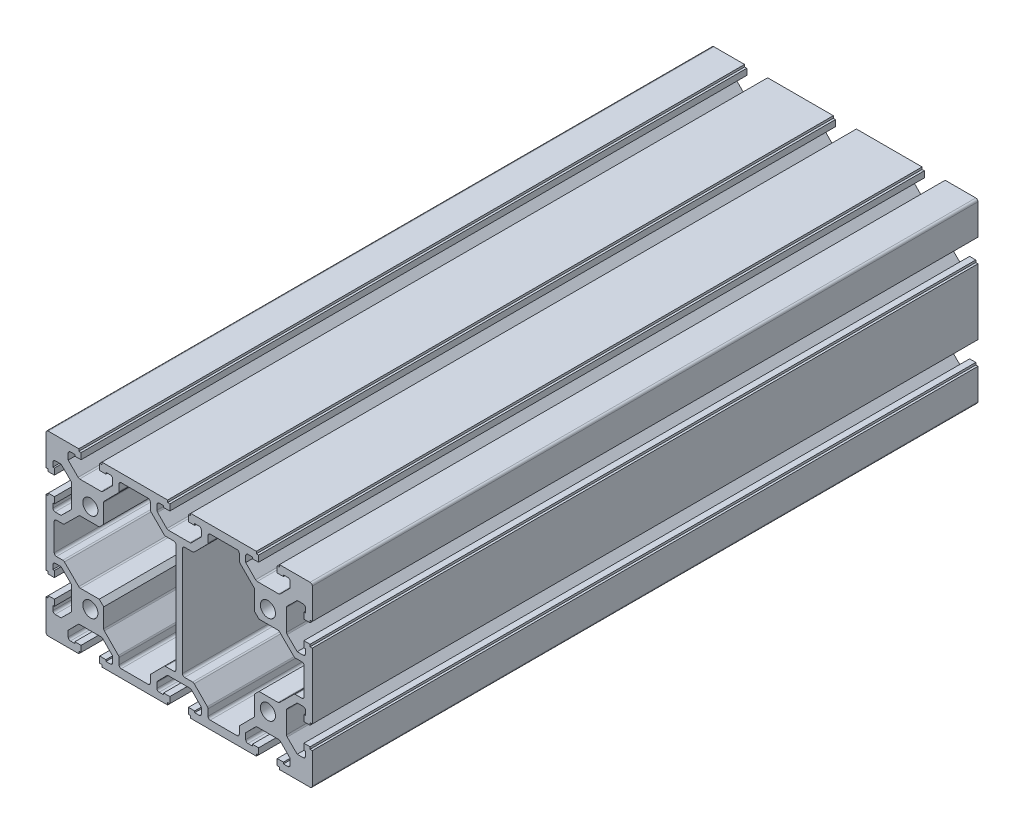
SolidWorks part; units mm, degrees
ref_plane "前视基准面" through (0, 0, 0) normal (0, 0, 1) x (1, 0, 0)
ref_plane "上视基准面" through (0, 0, 0) normal (0, 1, 0) x (1, 0, 0)
ref_plane "右视基准面" through (0, 0, 0) normal (1, 0, 0) x (0, 0, -1)
sketch "Model" plane through (0, 0, 0) normal (0, 0, 1) x (1, 0, 0)
  line L248 (1930.6182, 2016.6845) -> (1930.6182, 1992.2845)
  line L249 (1931.6182, 1991.2845) -> (1935.2528, 1991.2845)
  line L250 (1935.9636, 1990.9879) -> (1941.879, 1985.0102)
  line L251 (1942.1682, 1984.3068) -> (1942.1682, 1981.3845)
  line L252 (1943.1682, 1980.3845) -> (1955.2682, 1980.3845)
  line L253 (1956.2682, 1981.3845) -> (1956.2682, 1984.2657)
  line L254 (1956.5574, 1984.9691) -> (1962.879, 1991.3572)
  line L255 (1963.1682, 1992.0606) -> (1963.1682, 2000.5845)
  line L256 (1963.1682, 2000.5845) -> (1965.1682, 2002.5845)
  line L257 (1965.1682, 2002.5845) -> (1973.691, 2002.5845)
  line L258 (1974.3944, 2002.8737) -> (1980.8836, 2009.2953)
  line L259 (1981.587, 2009.5845) -> (1984.4682, 2009.5845)
  line L260 (1985.4682, 2010.5845) -> (1985.4682, 2016.6845)
  line L261 (1985.4682, 2016.6845) -> (1985.4682, 2022.7845)
  line L262 (1984.4682, 2023.7845) -> (1981.587, 2023.7845)
  line L263 (1980.8836, 2024.0737) -> (1974.3944, 2030.4953)
  line L264 (1973.691, 2030.7845) -> (1965.1682, 2030.7845)
  line L265 (1965.1682, 2030.7845) -> (1963.1682, 2032.7845)
  line L266 (1963.1682, 2032.7845) -> (1963.1682, 2041.3084)
  line L267 (1962.879, 2042.0118) -> (1956.5574, 2048.3999)
  line L268 (1956.2682, 2049.1033) -> (1956.2682, 2051.9845)
  line L269 (1955.2682, 2052.9845) -> (1943.1682, 2052.9845)
  line L270 (1942.1682, 2051.9845) -> (1942.1682, 2049.0622)
  line L271 (1941.879, 2048.3588) -> (1935.9636, 2042.3811)
  line L272 (1935.2528, 2042.0845) -> (1931.6182, 2042.0845)
  line L273 (1930.6182, 2041.0845) -> (1930.6182, 2016.6845)
  line L274 (1924.3355, 1988.2845) -> (1929.1682, 1988.2845)
  line L275 (1929.1682, 1988.2845) -> (1934.0009, 1988.2845)
  line L276 (1934.7117, 1987.9879) -> (1938.879, 1983.7768)
  line L277 (1939.1682, 1983.0734) -> (1939.1682, 1980.7845)
  line L278 (1938.1682, 1979.7845) -> (1936.1682, 1979.7845)
  line L279 (1936.1682, 1979.7845) -> (1936.1682, 1980.4845)
  line L280 (1936.1682, 1980.4845) -> (1933.3682, 1980.4845)
  line L281 (1933.3682, 1980.4845) -> (1933.3682, 1977.6845)
  line L282 (1933.3682, 1977.6845) -> (1934.3682, 1977.6845)
  line L283 (1934.3682, 1977.6845) -> (1934.3682, 1976.6845)
  line L284 (1934.3682, 1976.6845) -> (1963.9682, 1976.6845)
  line L285 (1963.9682, 1976.6845) -> (1963.9682, 1977.6845)
  line L286 (1963.9682, 1977.6845) -> (1964.9682, 1977.6845)
  line L287 (1964.9682, 1977.6845) -> (1964.9682, 1980.4845)
  line L288 (1964.9682, 1980.4845) -> (1962.1682, 1980.4845)
  line L289 (1962.1682, 1980.4845) -> (1962.1682, 1979.7845)
  line L290 (1962.1682, 1979.7845) -> (1960.1682, 1979.7845)
  line L291 (1959.1682, 1980.7845) -> (1959.1682, 1983.4845)
  line L292 (1959.1682, 1983.4845) -> (1963.6247, 1987.9879)
  line L293 (1964.3355, 1988.2845) -> (1969.1682, 1988.2845)
  line L294 (1969.1682, 1988.2845) -> (1974.0009, 1988.2845)
  line L295 (1974.7117, 1987.9879) -> (1979.1682, 1983.4845)
  line L296 (1979.1682, 1983.4845) -> (1979.1682, 1980.7845)
  line L297 (1978.1682, 1979.7845) -> (1976.1682, 1979.7845)
  line L298 (1976.1682, 1979.7845) -> (1976.1682, 1980.4845)
  line L299 (1976.1682, 1980.4845) -> (1973.3682, 1980.4845)
  line L300 (1973.3682, 1980.4845) -> (1973.3682, 1977.6845)
  line L301 (1973.3682, 1977.6845) -> (1974.3682, 1977.6845)
  line L302 (1974.3682, 1977.6845) -> (1974.3682, 1976.6845)
  line L303 (1974.3682, 1976.6845) -> (1988.1682, 1976.6845)
  line L304 (1989.1682, 1977.6845) -> (1989.1682, 1991.4845)
  line L305 (1989.1682, 1991.4845) -> (1988.1682, 1991.4845)
  line L306 (1988.1682, 1991.4845) -> (1988.1682, 1992.4845)
  line L307 (1988.1682, 1992.4845) -> (1985.3682, 1992.4845)
  line L308 (1985.3682, 1992.4845) -> (1985.3682, 1989.6845)
  line L309 (1985.3682, 1989.6845) -> (1986.0682, 1989.6845)
  line L310 (1986.0682, 1989.6845) -> (1986.0682, 1987.6845)
  line L311 (1985.0682, 1986.6845) -> (1982.3682, 1986.6845)
  line L312 (1982.3682, 1986.6845) -> (1977.8648, 1991.141)
  line L313 (1977.5682, 1991.8518) -> (1977.5682, 1996.6845)
  line L314 (1977.5682, 1996.6845) -> (1977.5682, 2001.5172)
  line L315 (1977.8648, 2002.228) -> (1982.3682, 2006.6845)
  line L316 (1982.3682, 2006.6845) -> (1985.0682, 2006.6845)
  line L317 (1986.0682, 2005.6845) -> (1986.0682, 2003.6845)
  line L318 (1986.0682, 2003.6845) -> (1985.3682, 2003.6845)
  line L319 (1985.3682, 2003.6845) -> (1985.3682, 2000.8845)
  line L320 (1985.3682, 2000.8845) -> (1988.1682, 2000.8845)
  line L321 (1988.1682, 2000.8845) -> (1988.1682, 2001.8845)
  line L322 (1988.1682, 2001.8845) -> (1989.1682, 2001.8845)
  line L323 (1989.1682, 2001.8845) -> (1989.1682, 2016.6845)
  line L324 (1989.1682, 2016.6845) -> (1989.1682, 2031.4845)
  line L325 (1989.1682, 2031.4845) -> (1988.1682, 2031.4845)
  line L326 (1988.1682, 2031.4845) -> (1988.1682, 2032.4845)
  line L327 (1988.1682, 2032.4845) -> (1985.3682, 2032.4845)
  line L328 (1985.3682, 2032.4845) -> (1985.3682, 2029.6845)
  line L329 (1985.3682, 2029.6845) -> (1986.0682, 2029.6845)
  line L330 (1986.0682, 2029.6845) -> (1986.0682, 2027.6845)
  line L331 (1985.0682, 2026.6845) -> (1982.3682, 2026.6845)
  line L332 (1982.3682, 2026.6845) -> (1977.8648, 2031.141)
  line L333 (1977.5682, 2031.8518) -> (1977.5682, 2036.6845)
  line L334 (1977.5682, 2036.6845) -> (1977.5682, 2041.5172)
  line L335 (1977.8648, 2042.228) -> (1982.3682, 2046.6845)
  line L336 (1982.3682, 2046.6845) -> (1985.0682, 2046.6845)
  line L337 (1986.0682, 2045.6845) -> (1986.0682, 2043.6845)
  line L338 (1986.0682, 2043.6845) -> (1985.3682, 2043.6845)
  line L339 (1985.3682, 2043.6845) -> (1985.3682, 2040.8845)
  line L340 (1985.3682, 2040.8845) -> (1988.1682, 2040.8845)
  line L341 (1988.1682, 2040.8845) -> (1988.1682, 2041.8845)
  line L342 (1988.1682, 2041.8845) -> (1989.1682, 2041.8845)
  line L343 (1989.1682, 2041.8845) -> (1989.1682, 2055.6845)
  line L344 (1988.1682, 2056.6845) -> (1974.3682, 2056.6845)
  line L345 (1974.3682, 2056.6845) -> (1974.3682, 2055.6845)
  line L346 (1974.3682, 2055.6845) -> (1973.3682, 2055.6845)
  line L347 (1973.3682, 2055.6845) -> (1973.3682, 2052.8845)
  line L348 (1973.3682, 2052.8845) -> (1976.1682, 2052.8845)
  line L349 (1976.1682, 2052.8845) -> (1976.1682, 2053.5845)
  line L350 (1976.1682, 2053.5845) -> (1978.1682, 2053.5845)
  line L351 (1979.1682, 2052.5845) -> (1979.1682, 2049.8845)
  line L352 (1979.1682, 2049.8845) -> (1974.7117, 2045.3811)
  line L353 (1974.0009, 2045.0845) -> (1969.1682, 2045.0845)
  line L354 (1969.1682, 2045.0845) -> (1964.3355, 2045.0845)
  line L355 (1963.6247, 2045.3811) -> (1959.1682, 2049.8845)
  line L356 (1959.1682, 2049.8845) -> (1959.1682, 2052.5845)
  line L357 (1960.1682, 2053.5845) -> (1962.1682, 2053.5845)
  line L358 (1962.1682, 2053.5845) -> (1962.1682, 2052.8845)
  line L359 (1962.1682, 2052.8845) -> (1964.9682, 2052.8845)
  line L360 (1964.9682, 2052.8845) -> (1964.9682, 2055.6845)
  line L361 (1964.9682, 2055.6845) -> (1963.9682, 2055.6845)
  line L362 (1963.9682, 2055.6845) -> (1963.9682, 2056.6845)
  line L363 (1963.9682, 2056.6845) -> (1934.3682, 2056.6845)
  line L364 (1934.3682, 2056.6845) -> (1934.3682, 2055.6845)
  line L365 (1934.3682, 2055.6845) -> (1933.3682, 2055.6845)
  line L366 (1933.3682, 2055.6845) -> (1933.3682, 2052.8845)
  line L367 (1933.3682, 2052.8845) -> (1936.1682, 2052.8845)
  line L368 (1936.1682, 2052.8845) -> (1936.1682, 2053.5845)
  line L369 (1936.1682, 2053.5845) -> (1938.1682, 2053.5845)
  line L370 (1939.1682, 2052.5845) -> (1939.1682, 2050.2957)
  line L371 (1938.879, 2049.5923) -> (1934.7117, 2045.3811)
  line L372 (1934.0009, 2045.0845) -> (1929.1682, 2045.0845)
  line L373 (1929.1682, 2045.0845) -> (1924.3355, 2045.0845)
  line L374 (1923.6247, 2045.3811) -> (1919.4574, 2049.5923)
  line L375 (1919.1682, 2050.2957) -> (1919.1682, 2052.5845)
  line L376 (1920.1682, 2053.5845) -> (1922.1682, 2053.5845)
  line L377 (1922.1682, 2053.5845) -> (1922.1682, 2052.8845)
  line L378 (1922.1682, 2052.8845) -> (1924.9682, 2052.8845)
  line L379 (1924.9682, 2052.8845) -> (1924.9682, 2055.6845)
  line L380 (1924.9682, 2055.6845) -> (1923.9682, 2055.6845)
  line L381 (1923.9682, 2055.6845) -> (1923.9682, 2056.6845)
  line L382 (1923.9682, 2056.6845) -> (1894.3682, 2056.6845)
  line L383 (1894.3682, 2056.6845) -> (1894.3682, 2055.6845)
  line L384 (1894.3682, 2055.6845) -> (1893.3682, 2055.6845)
  line L385 (1893.3682, 2055.6845) -> (1893.3682, 2052.8845)
  line L386 (1893.3682, 2052.8845) -> (1896.1682, 2052.8845)
  line L387 (1896.1682, 2052.8845) -> (1896.1682, 2053.5845)
  line L388 (1896.1682, 2053.5845) -> (1898.1682, 2053.5845)
  line L389 (1899.1682, 2052.5845) -> (1899.1682, 2049.8845)
  line L390 (1899.1682, 2049.8845) -> (1894.7117, 2045.3811)
  line L391 (1894.0009, 2045.0845) -> (1889.1682, 2045.0845)
  line L392 (1889.1682, 2045.0845) -> (1884.3355, 2045.0845)
  line L393 (1883.6247, 2045.3811) -> (1879.1682, 2049.8845)
  line L394 (1879.1682, 2049.8845) -> (1879.1682, 2052.5845)
  line L395 (1880.1682, 2053.5845) -> (1882.1682, 2053.5845)
  line L396 (1882.1682, 2053.5845) -> (1882.1682, 2052.8845)
  line L397 (1882.1682, 2052.8845) -> (1884.9682, 2052.8845)
  line L398 (1884.9682, 2052.8845) -> (1884.9682, 2055.6845)
  line L399 (1884.9682, 2055.6845) -> (1883.9682, 2055.6845)
  line L400 (1883.9682, 2055.6845) -> (1883.9682, 2056.6845)
  line L401 (1883.9682, 2056.6845) -> (1870.1682, 2056.6845)
  line L402 (1869.1682, 2055.6845) -> (1869.1682, 2041.8845)
  line L403 (1869.1682, 2041.8845) -> (1870.1682, 2041.8845)
  line L404 (1870.1682, 2041.8845) -> (1870.1682, 2040.8845)
  line L405 (1870.1682, 2040.8845) -> (1872.9682, 2040.8845)
  line L406 (1872.9682, 2040.8845) -> (1872.9682, 2043.6845)
  line L407 (1872.9682, 2043.6845) -> (1872.2682, 2043.6845)
  line L408 (1872.2682, 2043.6845) -> (1872.2682, 2045.6845)
  line L409 (1873.2682, 2046.6845) -> (1875.9682, 2046.6845)
  line L410 (1875.9682, 2046.6845) -> (1880.4716, 2042.228)
  line L411 (1880.7682, 2041.5172) -> (1880.7682, 2036.6845)
  line L412 (1880.7682, 2036.6845) -> (1880.7682, 2031.8518)
  line L413 (1880.4716, 2031.141) -> (1875.9682, 2026.6845)
  line L414 (1875.9682, 2026.6845) -> (1873.2682, 2026.6845)
  line L415 (1872.2682, 2027.6845) -> (1872.2682, 2029.6845)
  line L416 (1872.2682, 2029.6845) -> (1872.9682, 2029.6845)
  line L417 (1872.9682, 2029.6845) -> (1872.9682, 2032.4845)
  line L418 (1872.9682, 2032.4845) -> (1870.1682, 2032.4845)
  line L419 (1870.1682, 2032.4845) -> (1870.1682, 2031.4845)
  line L420 (1870.1682, 2031.4845) -> (1869.1682, 2031.4845)
  line L421 (1869.1682, 2031.4845) -> (1869.1682, 2016.6845)
  line L422 (1869.1682, 2016.6845) -> (1869.1682, 2001.8845)
  line L423 (1869.1682, 2001.8845) -> (1870.1682, 2001.8845)
  line L424 (1870.1682, 2001.8845) -> (1870.1682, 2000.8845)
  line L425 (1870.1682, 2000.8845) -> (1872.9682, 2000.8845)
  line L426 (1872.9682, 2000.8845) -> (1872.9682, 2003.6845)
  line L427 (1872.9682, 2003.6845) -> (1872.2682, 2003.6845)
  line L428 (1872.2682, 2003.6845) -> (1872.2682, 2005.6845)
  line L429 (1873.2682, 2006.6845) -> (1875.9682, 2006.6845)
  line L430 (1875.9682, 2006.6845) -> (1880.4716, 2002.228)
  line L431 (1880.7682, 2001.5172) -> (1880.7682, 1996.6845)
  line L432 (1880.7682, 1996.6845) -> (1880.7682, 1991.8518)
  line L433 (1880.4716, 1991.141) -> (1875.9682, 1986.6845)
  line L434 (1875.9682, 1986.6845) -> (1873.2682, 1986.6845)
  line L435 (1872.2682, 1987.6845) -> (1872.2682, 1989.6845)
  line L436 (1872.2682, 1989.6845) -> (1872.9682, 1989.6845)
  line L437 (1872.9682, 1989.6845) -> (1872.9682, 1992.4845)
  line L438 (1872.9682, 1992.4845) -> (1870.1682, 1992.4845)
  line L439 (1870.1682, 1992.4845) -> (1870.1682, 1991.4845)
  line L440 (1870.1682, 1991.4845) -> (1869.1682, 1991.4845)
  line L441 (1869.1682, 1991.4845) -> (1869.1682, 1977.6845)
  line L442 (1870.1682, 1976.6845) -> (1883.9682, 1976.6845)
  line L443 (1883.9682, 1976.6845) -> (1883.9682, 1977.6845)
  line L444 (1883.9682, 1977.6845) -> (1884.9682, 1977.6845)
  line L445 (1884.9682, 1977.6845) -> (1884.9682, 1980.4845)
  line L446 (1884.9682, 1980.4845) -> (1882.1682, 1980.4845)
  line L447 (1882.1682, 1980.4845) -> (1882.1682, 1979.7845)
  line L448 (1882.1682, 1979.7845) -> (1880.1682, 1979.7845)
  line L449 (1879.1682, 1980.7845) -> (1879.1682, 1983.4845)
  line L450 (1879.1682, 1983.4845) -> (1883.6247, 1987.9879)
  line L451 (1884.3355, 1988.2845) -> (1889.1682, 1988.2845)
  line L452 (1889.1682, 1988.2845) -> (1894.0009, 1988.2845)
  line L453 (1894.7117, 1987.9879) -> (1899.1682, 1983.4845)
  line L454 (1899.1682, 1983.4845) -> (1899.1682, 1980.7845)
  line L455 (1898.1682, 1979.7845) -> (1896.1682, 1979.7845)
  line L456 (1896.1682, 1979.7845) -> (1896.1682, 1980.4845)
  line L457 (1896.1682, 1980.4845) -> (1893.3682, 1980.4845)
  line L458 (1893.3682, 1980.4845) -> (1893.3682, 1977.6845)
  line L459 (1893.3682, 1977.6845) -> (1894.3682, 1977.6845)
  line L460 (1894.3682, 1977.6845) -> (1894.3682, 1976.6845)
  line L461 (1894.3682, 1976.6845) -> (1923.9682, 1976.6845)
  line L462 (1923.9682, 1976.6845) -> (1923.9682, 1977.6845)
  line L463 (1923.9682, 1977.6845) -> (1924.9682, 1977.6845)
  line L464 (1924.9682, 1977.6845) -> (1924.9682, 1980.4845)
  line L465 (1924.9682, 1980.4845) -> (1922.1682, 1980.4845)
  line L466 (1922.1682, 1980.4845) -> (1922.1682, 1979.7845)
  line L467 (1922.1682, 1979.7845) -> (1920.1682, 1979.7845)
  line L468 (1919.1682, 1980.7845) -> (1919.1682, 1983.0734)
  line L469 (1919.4574, 1983.7768) -> (1923.6247, 1987.9879)
  line L470 (1927.7182, 1992.2845) -> (1927.7182, 2016.6845)
  line L471 (1927.7182, 2016.6845) -> (1927.7182, 2041.0845)
  line L472 (1926.7182, 2042.0845) -> (1923.0836, 2042.0845)
  line L473 (1922.3728, 2042.3811) -> (1916.4574, 2048.3588)
  line L474 (1916.1682, 2049.0622) -> (1916.1682, 2051.9845)
  line L475 (1915.1682, 2052.9845) -> (1903.0682, 2052.9845)
  line L476 (1902.0682, 2051.9845) -> (1902.0682, 2049.1033)
  line L477 (1901.779, 2048.3999) -> (1895.4574, 2042.0118)
  line L478 (1895.1682, 2041.3084) -> (1895.1682, 2032.7845)
  line L479 (1895.1682, 2032.7845) -> (1893.1682, 2030.7845)
  line L480 (1893.1682, 2030.7845) -> (1884.6454, 2030.7845)
  line L481 (1883.942, 2030.4953) -> (1877.4528, 2024.0737)
  line L482 (1876.7494, 2023.7845) -> (1873.8682, 2023.7845)
  line L483 (1872.8682, 2022.7845) -> (1872.8682, 2016.6845)
  line L484 (1872.8682, 2016.6845) -> (1872.8682, 2010.5845)
  line L485 (1873.8682, 2009.5845) -> (1876.7494, 2009.5845)
  line L486 (1877.4528, 2009.2953) -> (1883.942, 2002.8737)
  line L487 (1884.6454, 2002.5845) -> (1893.1682, 2002.5845)
  line L488 (1893.1682, 2002.5845) -> (1895.1682, 2000.5845)
  line L489 (1895.1682, 2000.5845) -> (1895.1682, 1992.0606)
  line L490 (1895.4574, 1991.3572) -> (1901.779, 1984.9691)
  line L491 (1902.0682, 1984.2657) -> (1902.0682, 1981.3845)
  line L492 (1903.0682, 1980.3845) -> (1915.1682, 1980.3845)
  line L493 (1916.1682, 1981.3845) -> (1916.1682, 1984.3068)
  line L494 (1916.4574, 1985.0102) -> (1922.3728, 1990.9879)
  line L495 (1923.0836, 1991.2845) -> (1926.7182, 1991.2845)
  circle A92 centre (1969.1682, 2036.6845) radius 3.4
  circle A93 centre (1889.1682, 2036.6845) radius 3.4
  circle A94 centre (1969.1682, 1996.6845) radius 3.4
  circle A95 centre (1889.1682, 1996.6845) radius 3.4
  arc A96 (1930.6182, 1992.2845) -> (1931.6182, 1991.2845) centre (1931.6182, 1992.2845) ccw
  arc A97 (1935.9636, 1990.9879) -> (1935.2528, 1991.2845) centre (1935.2528, 1990.2845) ccw
  arc A98 (1942.1682, 1984.3068) -> (1941.879, 1985.0102) centre (1941.1682, 1984.3068) ccw
  arc A99 (1942.1682, 1981.3845) -> (1943.1682, 1980.3845) centre (1943.1682, 1981.3845) ccw
  arc A100 (1955.2682, 1980.3845) -> (1956.2682, 1981.3845) centre (1955.2682, 1981.3845) ccw
  arc A101 (1956.5574, 1984.9691) -> (1956.2682, 1984.2657) centre (1957.2682, 1984.2657) ccw
  arc A102 (1962.879, 1991.3572) -> (1963.1682, 1992.0606) centre (1962.1682, 1992.0606) ccw
  arc A103 (1973.691, 2002.5845) -> (1974.3944, 2002.8737) centre (1973.691, 2003.5845) ccw
  arc A104 (1981.587, 2009.5845) -> (1980.8836, 2009.2953) centre (1981.587, 2008.5845) ccw
  arc A105 (1984.4682, 2009.5845) -> (1985.4682, 2010.5845) centre (1984.4682, 2010.5845) ccw
  arc A106 (1985.4682, 2022.7845) -> (1984.4682, 2023.7845) centre (1984.4682, 2022.7845) ccw
  arc A107 (1980.8836, 2024.0737) -> (1981.587, 2023.7845) centre (1981.587, 2024.7845) ccw
  arc A108 (1974.3944, 2030.4953) -> (1973.691, 2030.7845) centre (1973.691, 2029.7845) ccw
  arc A109 (1963.1682, 2041.3084) -> (1962.879, 2042.0118) centre (1962.1682, 2041.3084) ccw
  arc A110 (1956.2682, 2049.1033) -> (1956.5574, 2048.3999) centre (1957.2682, 2049.1033) ccw
  arc A111 (1956.2682, 2051.9845) -> (1955.2682, 2052.9845) centre (1955.2682, 2051.9845) ccw
  arc A112 (1943.1682, 2052.9845) -> (1942.1682, 2051.9845) centre (1943.1682, 2051.9845) ccw
  arc A113 (1941.879, 2048.3588) -> (1942.1682, 2049.0622) centre (1941.1682, 2049.0622) ccw
  arc A114 (1935.2528, 2042.0845) -> (1935.9636, 2042.3811) centre (1935.2528, 2043.0845) ccw
  arc A115 (1931.6182, 2042.0845) -> (1930.6182, 2041.0845) centre (1931.6182, 2041.0845) ccw
  arc A116 (1924.3355, 1988.2845) -> (1923.6247, 1987.9879) centre (1924.3355, 1987.2845) ccw
  arc A117 (1934.7117, 1987.9879) -> (1934.0009, 1988.2845) centre (1934.0009, 1987.2845) ccw
  arc A118 (1939.1682, 1983.0734) -> (1938.879, 1983.7768) centre (1938.1682, 1983.0734) ccw
  arc A119 (1938.1682, 1979.7845) -> (1939.1682, 1980.7845) centre (1938.1682, 1980.7845) ccw
  arc A120 (1959.1682, 1980.7845) -> (1960.1682, 1979.7845) centre (1960.1682, 1980.7845) ccw
  arc A121 (1964.3355, 1988.2845) -> (1963.6247, 1987.9879) centre (1964.3355, 1987.2845) ccw
  arc A122 (1974.7117, 1987.9879) -> (1974.0009, 1988.2845) centre (1974.0009, 1987.2845) ccw
  arc A123 (1978.1682, 1979.7845) -> (1979.1682, 1980.7845) centre (1978.1682, 1980.7845) ccw
  arc A124 (1988.1682, 1976.6845) -> (1989.1682, 1977.6845) centre (1988.1682, 1977.6845) ccw
  arc A125 (1985.0682, 1986.6845) -> (1986.0682, 1987.6845) centre (1985.0682, 1987.6845) ccw
  arc A126 (1977.5682, 1991.8518) -> (1977.8648, 1991.141) centre (1978.5682, 1991.8518) ccw
  arc A127 (1977.8648, 2002.228) -> (1977.5682, 2001.5172) centre (1978.5682, 2001.5172) ccw
  arc A128 (1986.0682, 2005.6845) -> (1985.0682, 2006.6845) centre (1985.0682, 2005.6845) ccw
  arc A129 (1985.0682, 2026.6845) -> (1986.0682, 2027.6845) centre (1985.0682, 2027.6845) ccw
  arc A130 (1977.5682, 2031.8518) -> (1977.8648, 2031.141) centre (1978.5682, 2031.8518) ccw
  arc A131 (1977.8648, 2042.228) -> (1977.5682, 2041.5172) centre (1978.5682, 2041.5172) ccw
  arc A132 (1986.0682, 2045.6845) -> (1985.0682, 2046.6845) centre (1985.0682, 2045.6845) ccw
  arc A133 (1989.1682, 2055.6845) -> (1988.1682, 2056.6845) centre (1988.1682, 2055.6845) ccw
  arc A134 (1979.1682, 2052.5845) -> (1978.1682, 2053.5845) centre (1978.1682, 2052.5845) ccw
  arc A135 (1974.0009, 2045.0845) -> (1974.7117, 2045.3811) centre (1974.0009, 2046.0845) ccw
  arc A136 (1963.6247, 2045.3811) -> (1964.3355, 2045.0845) centre (1964.3355, 2046.0845) ccw
  arc A137 (1960.1682, 2053.5845) -> (1959.1682, 2052.5845) centre (1960.1682, 2052.5845) ccw
  arc A138 (1939.1682, 2052.5845) -> (1938.1682, 2053.5845) centre (1938.1682, 2052.5845) ccw
  arc A139 (1938.879, 2049.5923) -> (1939.1682, 2050.2957) centre (1938.1682, 2050.2957) ccw
  arc A140 (1934.0009, 2045.0845) -> (1934.7117, 2045.3811) centre (1934.0009, 2046.0845) ccw
  arc A141 (1923.6247, 2045.3811) -> (1924.3355, 2045.0845) centre (1924.3355, 2046.0845) ccw
  arc A142 (1919.1682, 2050.2957) -> (1919.4574, 2049.5923) centre (1920.1682, 2050.2957) ccw
  arc A143 (1920.1682, 2053.5845) -> (1919.1682, 2052.5845) centre (1920.1682, 2052.5845) ccw
  arc A144 (1899.1682, 2052.5845) -> (1898.1682, 2053.5845) centre (1898.1682, 2052.5845) ccw
  arc A145 (1894.0009, 2045.0845) -> (1894.7117, 2045.3811) centre (1894.0009, 2046.0845) ccw
  arc A146 (1883.6247, 2045.3811) -> (1884.3355, 2045.0845) centre (1884.3355, 2046.0845) ccw
  arc A147 (1880.1682, 2053.5845) -> (1879.1682, 2052.5845) centre (1880.1682, 2052.5845) ccw
  arc A148 (1870.1682, 2056.6845) -> (1869.1682, 2055.6845) centre (1870.1682, 2055.6845) ccw
  arc A149 (1873.2682, 2046.6845) -> (1872.2682, 2045.6845) centre (1873.2682, 2045.6845) ccw
  arc A150 (1880.7682, 2041.5172) -> (1880.4716, 2042.228) centre (1879.7682, 2041.5172) ccw
  arc A151 (1880.4716, 2031.141) -> (1880.7682, 2031.8518) centre (1879.7682, 2031.8518) ccw
  arc A152 (1872.2682, 2027.6845) -> (1873.2682, 2026.6845) centre (1873.2682, 2027.6845) ccw
  arc A153 (1873.2682, 2006.6845) -> (1872.2682, 2005.6845) centre (1873.2682, 2005.6845) ccw
  arc A154 (1880.7682, 2001.5172) -> (1880.4716, 2002.228) centre (1879.7682, 2001.5172) ccw
  arc A155 (1880.4716, 1991.141) -> (1880.7682, 1991.8518) centre (1879.7682, 1991.8518) ccw
  arc A156 (1872.2682, 1987.6845) -> (1873.2682, 1986.6845) centre (1873.2682, 1987.6845) ccw
  arc A157 (1869.1682, 1977.6845) -> (1870.1682, 1976.6845) centre (1870.1682, 1977.6845) ccw
  arc A158 (1879.1682, 1980.7845) -> (1880.1682, 1979.7845) centre (1880.1682, 1980.7845) ccw
  arc A159 (1884.3355, 1988.2845) -> (1883.6247, 1987.9879) centre (1884.3355, 1987.2845) ccw
  arc A160 (1894.7117, 1987.9879) -> (1894.0009, 1988.2845) centre (1894.0009, 1987.2845) ccw
  arc A161 (1898.1682, 1979.7845) -> (1899.1682, 1980.7845) centre (1898.1682, 1980.7845) ccw
  arc A162 (1919.1682, 1980.7845) -> (1920.1682, 1979.7845) centre (1920.1682, 1980.7845) ccw
  arc A163 (1919.4574, 1983.7768) -> (1919.1682, 1983.0734) centre (1920.1682, 1983.0734) ccw
  arc A164 (1927.7182, 2041.0845) -> (1926.7182, 2042.0845) centre (1926.7182, 2041.0845) ccw
  arc A165 (1922.3728, 2042.3811) -> (1923.0836, 2042.0845) centre (1923.0836, 2043.0845) ccw
  arc A166 (1916.1682, 2049.0622) -> (1916.4574, 2048.3588) centre (1917.1682, 2049.0622) ccw
  arc A167 (1916.1682, 2051.9845) -> (1915.1682, 2052.9845) centre (1915.1682, 2051.9845) ccw
  arc A168 (1903.0682, 2052.9845) -> (1902.0682, 2051.9845) centre (1903.0682, 2051.9845) ccw
  arc A169 (1901.779, 2048.3999) -> (1902.0682, 2049.1033) centre (1901.0682, 2049.1033) ccw
  arc A170 (1895.4574, 2042.0118) -> (1895.1682, 2041.3084) centre (1896.1682, 2041.3084) ccw
  arc A171 (1884.6454, 2030.7845) -> (1883.942, 2030.4953) centre (1884.6454, 2029.7845) ccw
  arc A172 (1876.7494, 2023.7845) -> (1877.4528, 2024.0737) centre (1876.7494, 2024.7845) ccw
  arc A173 (1873.8682, 2023.7845) -> (1872.8682, 2022.7845) centre (1873.8682, 2022.7845) ccw
  arc A174 (1872.8682, 2010.5845) -> (1873.8682, 2009.5845) centre (1873.8682, 2010.5845) ccw
  arc A175 (1877.4528, 2009.2953) -> (1876.7494, 2009.5845) centre (1876.7494, 2008.5845) ccw
  arc A176 (1883.942, 2002.8737) -> (1884.6454, 2002.5845) centre (1884.6454, 2003.5845) ccw
  arc A177 (1895.1682, 1992.0606) -> (1895.4574, 1991.3572) centre (1896.1682, 1992.0606) ccw
  arc A178 (1902.0682, 1984.2657) -> (1901.779, 1984.9691) centre (1901.0682, 1984.2657) ccw
  arc A179 (1902.0682, 1981.3845) -> (1903.0682, 1980.3845) centre (1903.0682, 1981.3845) ccw
  arc A180 (1915.1682, 1980.3845) -> (1916.1682, 1981.3845) centre (1915.1682, 1981.3845) ccw
  arc A181 (1916.4574, 1985.0102) -> (1916.1682, 1984.3068) centre (1917.1682, 1984.3068) ccw
  arc A182 (1923.0836, 1991.2845) -> (1922.3728, 1990.9879) centre (1923.0836, 1990.2845) ccw
  arc A183 (1926.7182, 1991.2845) -> (1927.7182, 1992.2845) centre (1926.7182, 1992.2845) ccw
extrude "凸台-拉伸1" add sketch "Model" along normal blind 300
